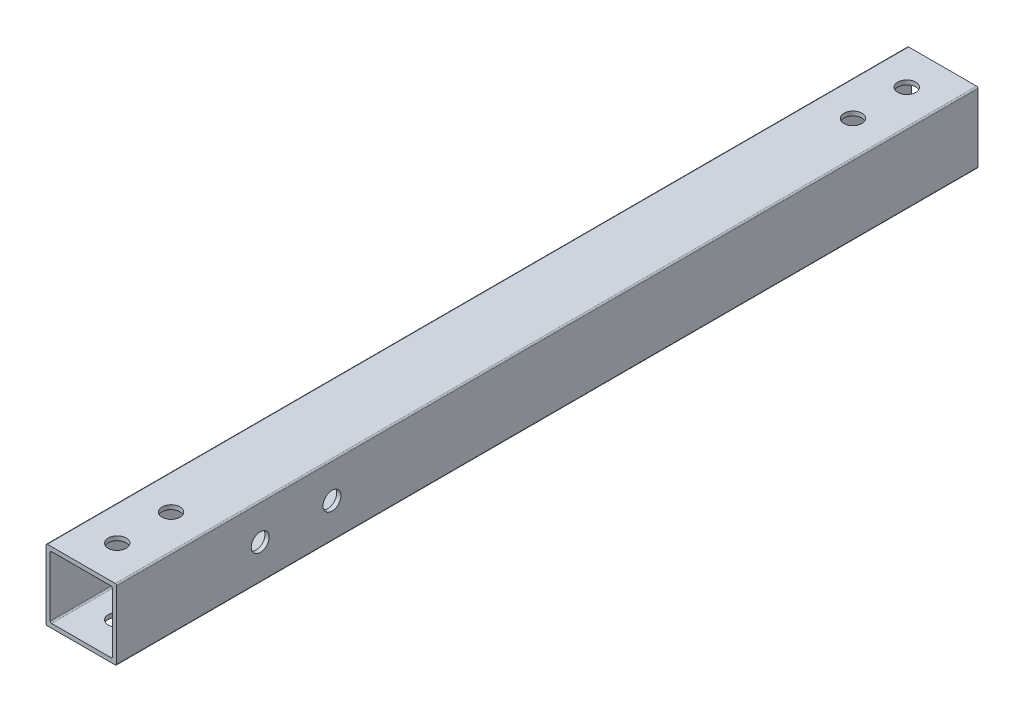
SolidWorks part; units mm, degrees
ref_plane "Front Plane" through (0, 0, 0) normal (0, 0, 1) x (1, 0, 0)
ref_plane "Top Plane" through (0, 0, 0) normal (0, 1, 0) x (1, 0, 0)
ref_plane "Right Plane" through (0, 0, 0) normal (1, 0, 0) x (0, 0, -1)
ref_plane "Plane1" through (0, 0, -2000) normal (0, 0, -1) x (-1, 0, 0)
sketch "Sketch1" plane through (0, 0, -2000) normal (0, 0, -1) x (-1, 0, 0)
  line L0 (11, 10.5) -> (11, -10.5)
  line L1 (10.5, -11) -> (-10.5, -11)
  line L2 (-11, -10.5) -> (-11, 10.5)
  line L3 (-10.5, 11) -> (10.5, 11)
  line L4 (12.5, -12) -> (12.5, 12)
  line L5 (12, 12.5) -> (-12, 12.5)
  line L6 (-12.5, 12) -> (-12.5, -12)
  line L7 (-12, -12.5) -> (12, -12.5)
  line L8 (0, 12.5) -> (0, -12.5) construction
  line L9 (-12.5, 0) -> (12.5, 0) construction
  arc A0 (11, -10.5) -> (10.5, -11) centre (10.5, -10.5) cw
  arc A1 (-10.5, -11) -> (-11, -10.5) centre (-10.5, -10.5) cw
  arc A2 (-11, 10.5) -> (-10.5, 11) centre (-10.5, 10.5) cw
  arc A3 (10.5, 11) -> (11, 10.5) centre (10.5, 10.5) cw
  arc A4 (12.5, 12) -> (12, 12.5) centre (12, 12) ccw
  arc A5 (-12, 12.5) -> (-12.5, 12) centre (-12, 12) ccw
  arc A6 (-12.5, -12) -> (-12, -12.5) centre (-12, -12) ccw
  arc A7 (12, -12.5) -> (12.5, -12) centre (12, -12) ccw
  dimension "D7" = 0.5
  dimension "D8" = 0.5
  dimension "D9" = 0.5
  dimension "D10" = 0.5
  dimension "D11" = 0.5
  dimension "D1" = 25
  dimension "D2" = 25
  dimension "D3" = 1.5
  dimension "D4" = 1.5
  dimension "D5" = 1.5
  dimension "D6" = 1.5
extrude "Boss-Extrude1" add sketch "Sketch1" against normal blind 304.8
sketch "Sketch2" plane through (0, 12.5, 0) normal (0, 1, 0) x (1, 0, 0)
  line L0 (0, 2000) -> (0, 1695.2) construction
  line L1 (-12, 2000) -> (12, 2000) construction
  line L2 (-12, 1695.2) -> (12, 1695.2) construction
  line L3 (-12, 1847.6) -> (12, 1847.6) construction
  line L4 (-12, 1695.2) -> (-12, 2000) construction
  line L5 (12, 1695.2) -> (12, 2000) construction
  circle A0 centre (0, 1987.3) radius 3.175
  circle A1 centre (0, 1968.25) radius 3.175
  circle A2 centre (0, 1707.9) radius 3.175
  circle A3 centre (0, 1726.95) radius 3.175
  dimension "D3" = 6.35
  dimension "D4" = 6.35
  dimension "D1" = 12.7
  dimension "D2" = 31.75
extrude "Cut-Extrude1" cut sketch "Sketch2" against normal up to surface (25 mm away)
sketch "Sketch3" plane through (12.5, 0, 0) normal (1, 0, 0) x (0, 0, -1)
  line L0 (1695.2, 0) -> (2000, 0) construction
  line L1 (1695.2, 12) -> (1695.2, -12) construction
  line L2 (2000, 12) -> (2000, -12) construction
  circle A0 centre (1771.4, 0) radius 3.175
  circle A1 centre (1746, 0) radius 3.175
  dimension "D1" = 6.35
  dimension "D2" = 6.35
  dimension "D3" = 25.4
  dimension "D4" = 50.8
extrude "Cut-Extrude2" cut sketch "Sketch3" against normal up to surface (25 mm away)
